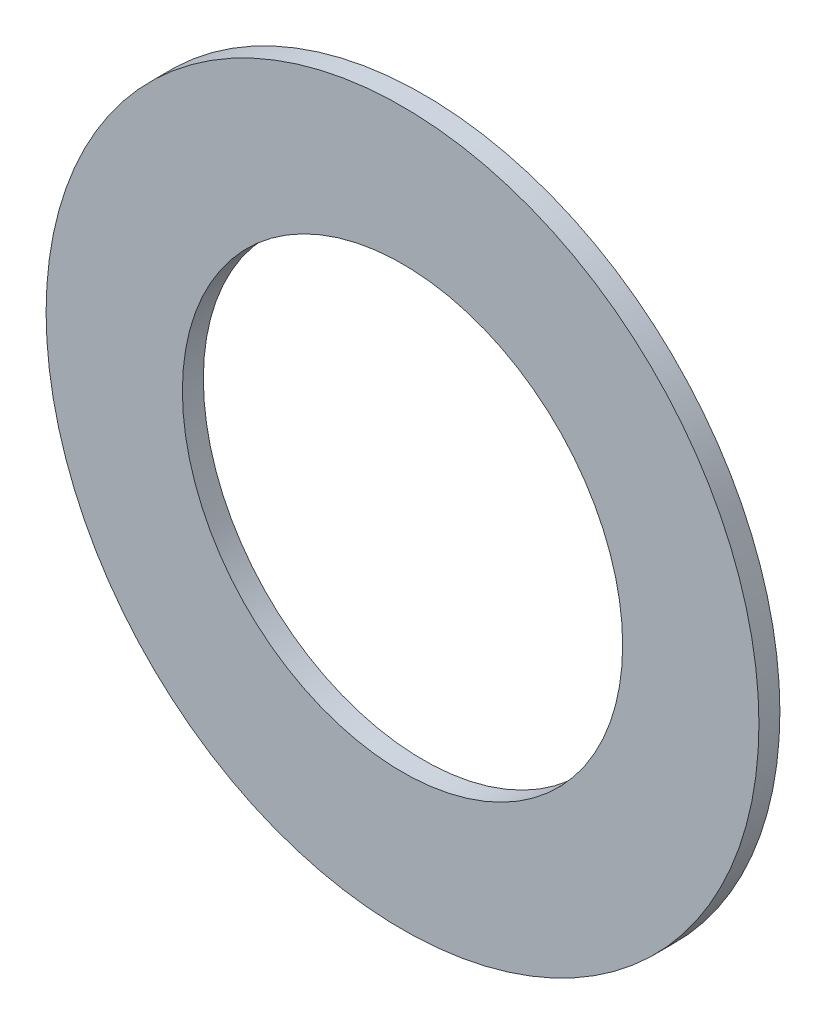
SolidWorks part; units mm, degrees
ref_plane "Face" through (0, 0, 0) normal (0, 0, 1) x (1, 0, 0)
ref_plane "Dessus" through (0, 0, 0) normal (0, 1, 0) x (1, 0, 0)
ref_plane "Droite" through (0, 0, 0) normal (1, 0, 0) x (0, 0, -1)
sketch "Esquisse1" plane through (0, 0, 0) normal (0, 0, 1) x (1, 0, 0)
  circle A0 centre (0, 0) radius 10.5
  circle A1 centre (0, 0) radius 17
  dimension "D1" = 21
  dimension "D2" = 34
extrude "Base-Extrusion" add sketch "Esquisse1" along normal blind 1
